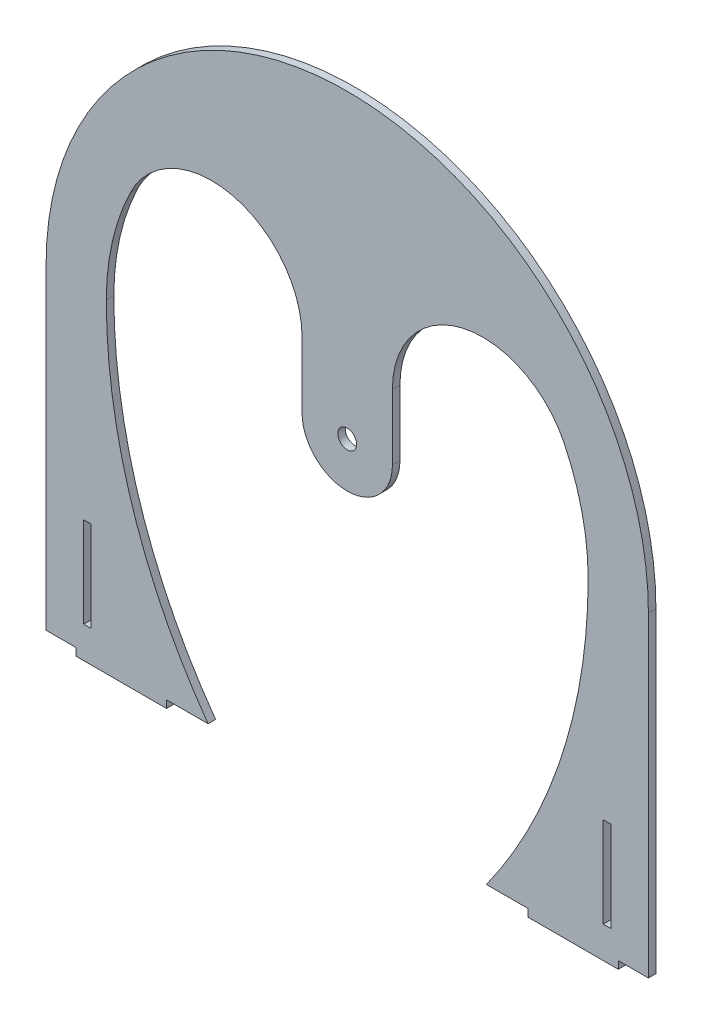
SolidWorks part; units mm, degrees
ref_plane "Front Plane" through (0, 0, 0) normal (0, 0, 1) x (1, 0, 0)
ref_plane "Top Plane" through (0, 0, 0) normal (0, 1, 0) x (1, 0, 0)
ref_plane "Right Plane" through (0, 0, 0) normal (1, 0, 0) x (0, 0, -1)
sketch "Sketch1" plane through (0, 0, 0) normal (0, 0, 1) x (1, 0, 0)
  line L0 (0, -133.35) -> (0, 0)
  line L1 (-127, -127) -> (127, -127)
  line L2 (-127, -127) -> (-127, 127)
  line L3 (-127, 127) -> (127, 127)
  line L4 (127, -127) -> (127, 127)
  line L5 (-127, -127) -> (127, 127) construction
  line L6 (-127, 127) -> (127, -127) construction
  line L7 (-19.05, -127) -> (19.05, -127)
  line L8 (-19.05, -127) -> (-19.05, 127)
  line L9 (-19.05, 127) -> (19.05, 127)
  line L10 (19.05, -127) -> (19.05, 127)
  line L11 (-19.05, -127) -> (19.05, 127) construction
  line L12 (-19.05, 127) -> (19.05, -127) construction
  line L13 (101.6, -127) -> (-101.6, -127)
  line L14 (101.6, -127) -> (101.6, 127)
  line L15 (101.6, 127) -> (-101.6, 127)
  line L16 (-101.6, -127) -> (-101.6, 127)
  line L17 (101.6, -127) -> (-101.6, 127) construction
  line L18 (101.6, 127) -> (-101.6, -127) construction
  line L19 (-127, -127) -> (127, -127)
  line L20 (-127, -127) -> (-127, -133.35)
  line L21 (-127, -133.35) -> (127, -133.35)
  line L22 (127, -127) -> (127, -133.35)
  line L23 (107.95, -85.09) -> (111.125, -85.09)
  line L24 (107.95, -85.09) -> (107.95, -123.19)
  line L25 (107.95, -123.19) -> (111.125, -123.19)
  line L26 (111.125, -85.09) -> (111.125, -123.19)
  line L27 (-107.95, -123.19) -> (-111.125, -123.19)
  line L28 (-107.95, -85.09) -> (-107.95, -123.19)
  line L29 (-107.95, -85.09) -> (-111.125, -85.09)
  line L30 (-111.125, -85.09) -> (-111.125, -123.19)
  circle A0 centre (0, 0) radius 3.9688
  circle A1 centre (0, 0) radius 19.05
  circle A2 centre (0, 0) radius 101.6
  circle A3 centre (0, 0) radius 127
  arc A4 (-101.6, 0) -> (-58.6764, -133.35) centre (127, 0) ccw
  arc A5 (101.6, 0) -> (58.6764, -133.35) centre (-127, 0) cw
  dimension "D1" = 7.9375
  dimension "D4" = 38.1
  dimension "D6" = 203.2
  dimension "D2" = 254
  dimension "D3" = 254
  dimension "D5" = 38.1
  dimension "D7" = 6.35
  dimension "D8" = 3.175
  dimension "D9" = 38.1
  dimension "D10" = 10.16
  dimension "D11" = 107.95
extrude "Boss-Extrude1" add sketch "Sketch1" along normal blind 3.175 contours A3 L2 L1 L16 | L16 A3 | L8 A3 L16 A2 | L10 A3 L8 A2 | L14 A3 L10 A2 | A3 L14 | A3 L14 L1 L4 | A1 A0 | L10 A2 L8 A1 | A4 A3 L16 L1 | A4 L16 A3 | A4 L1 L20 L21 | L19 A5 L21 L22 L1 | A3 A5 L19 L14 | L14 A5 A3
fillet "Fillet1" radius 38.1 2 edges at (19.05, 99.7981, 1.5875) (-19.05, 99.7981, 1.5875)
sketch "Sketch3" plane through (0, -133.35, 0) normal (0, -1, 0) x (1, 0, 0)
  line L0 (-127, 3.175) -> (-58.6764, 3.175) construction
  line L1 (-114.3, 3.175) -> (-76.2, 3.175)
  line L2 (-114.3, 3.175) -> (-114.3, 0)
  line L3 (-114.3, 0) -> (-76.2, 0)
  line L4 (-76.2, 3.175) -> (-76.2, 0)
  line L5 (-127, 0) -> (-58.6764, 0) construction
  line L6 (58.6764, 3.175) -> (127, 3.175) construction
  line L7 (76.2, 3.175) -> (114.3, 3.175)
  line L8 (76.2, 3.175) -> (76.2, 0)
  line L9 (76.2, 0) -> (114.3, 0)
  line L10 (114.3, 3.175) -> (114.3, 0)
  line L11 (58.6764, 0) -> (127, 0) construction
  dimension "D1" = 76.2
  dimension "D2" = 114.3
  dimension "D3" = 76.2
  dimension "D4" = 114.3
extrude "Boss-Extrude2" add sketch "Sketch3" along normal blind 3.175
